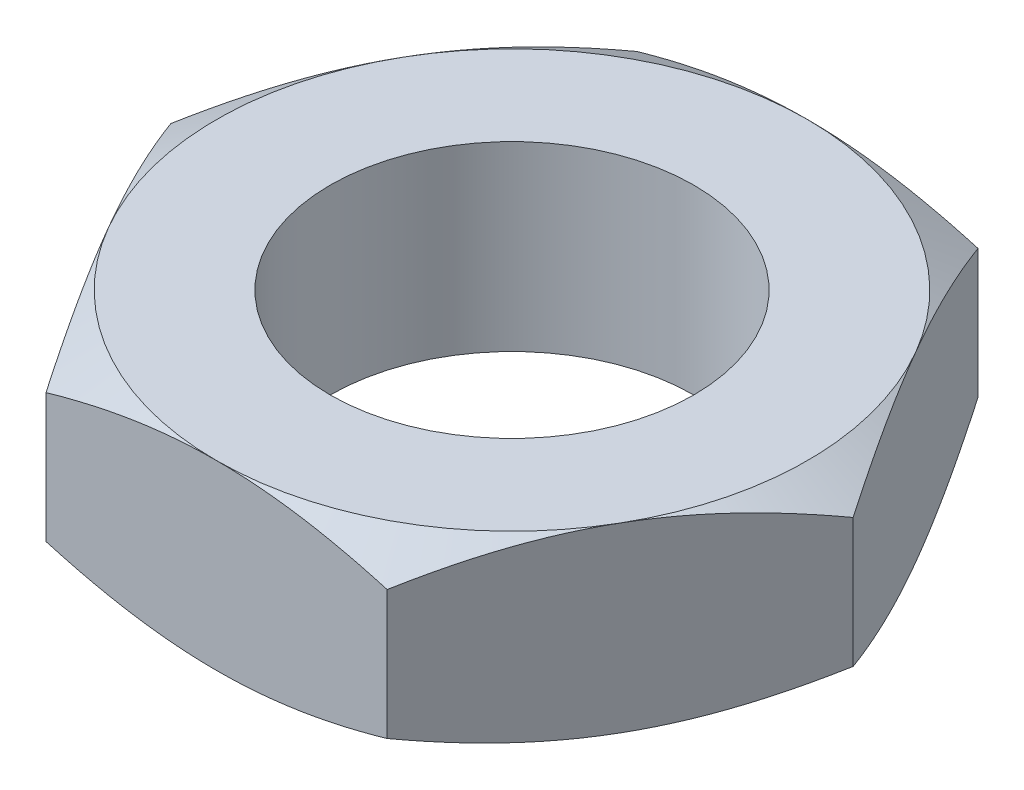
SolidWorks part; units mm, degrees
ref_plane "Front" through (0, 0, 0) normal (0, 0, 1) x (1, 0, 0)
ref_plane "Top" through (0, 0, 0) normal (0, 1, 0) x (1, 0, 0)
ref_plane "Right" through (0, 0, 0) normal (1, 0, 0) x (0, 0, -1)
sketch "Sketch3" plane through (0, 0, 0) normal (0, 1, 0) x (-1, 0, 0)
  line L1 (-7.5056, 0) -> (-3.7528, -6.5) construction
  line L2 (-3.7528, -6.5) -> (3.7528, -6.5) construction
  line L3 (3.7528, -6.5) -> (7.5056, 0) construction
  line L4 (7.5056, 0) -> (3.7528, 6.5) construction
  line L5 (3.7528, 6.5) -> (-3.7528, 6.5) construction
  line L6 (-3.7528, 6.5) -> (-7.5056, 0) construction
  circle A0 centre (0, 0) radius 6.5 construction
  dimension "D1" = 13
  dimension "D2" = 15.0111
sketch "Sketch2" plane through (0, 0, 0) normal (0, 0, 1) x (1, 0, 0)
  line L0 (0, -2) -> (0, 2) construction
  line L1 (6.5, 2) -> (7.5056, 1.4194)
  line L2 (4, -2) -> (6.5, -2)
  line L3 (4, -2) -> (4, 2)
  line L4 (4, 2) -> (6.5, 2)
  line L5 (7.5056, -1.4194) -> (7.5056, 1.4194)
  line L6 (6.5, -2) -> (7.5056, -1.4194)
  line L7 (6.5, 2) -> (6.5, -2) construction
  line L10 (6.5, 0) -> (-6.5, 0) construction
  point P4 (7.5056, 2)
  point P6 (7.5056, -2)
  point P11 (6.5, 0)
  dimension "D1" = 8
  dimension "D2" = 4
  dimension "D3" = 30
  dimension "D4" = 30
revolve "Base-Revolve" add sketch "Sketch2" angle 360 about L0
sketch "Sketch4" plane through (0, 2, 0) normal (0, 1, 0) x (-1, 0, 0)
  line L0 (-3.7528, 6.5) -> (-7.5056, 0) construction
  line L1 (-7.5056, 0) -> (-3.7528, -6.5)
  line L2 (-3.7528, -6.5) -> (3.7528, -6.5)
  line L3 (3.7528, -6.5) -> (7.5056, 0)
  line L4 (7.5056, 0) -> (3.7528, 6.5)
  line L5 (3.7528, 6.5) -> (-3.7528, 6.5)
  line L6 (-3.7528, 6.5) -> (-7.5056, 0)
  circle A0 centre (0, 0) radius 6.5 construction
  circle A1 centre (0, 0) radius 6.5 construction
extrude "Cut-Extrude1" cut sketch "Sketch4" against normal through all flip side to cut
equation "\"D4@Sketch2\" = \"D3@Sketch2\""
